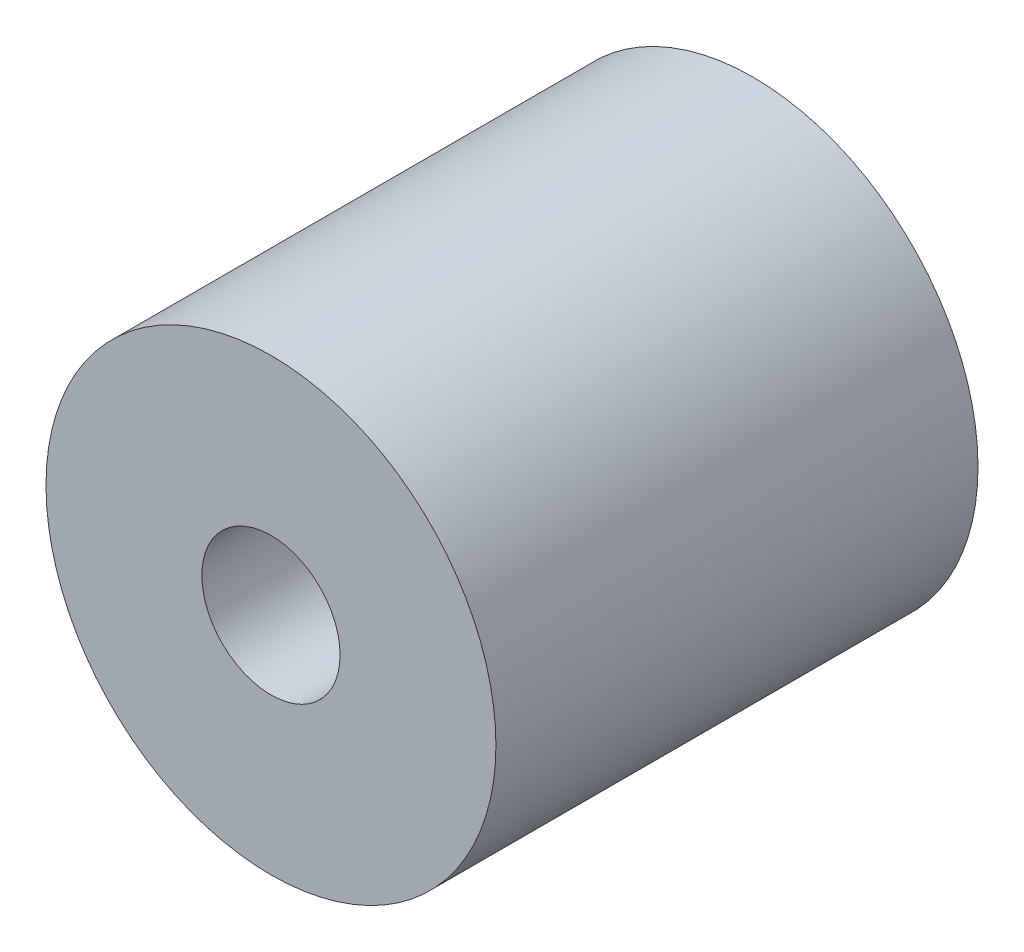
SolidWorks part; units mm, degrees
ref_plane "Plan de face" through (0, 0, 0) normal (0, 0, 1) x (1, 0, 0)
ref_plane "Plan de dessus" through (0, 0, 0) normal (0, 1, 0) x (1, 0, 0)
ref_plane "Plan de droite" through (0, 0, 0) normal (1, 0, 0) x (0, 0, -1)
sketch "Esquisse1" plane through (0, 0, 0) normal (0, 0, 1) x (1, 0, 0)
  circle A1 centre (76, 143) radius 14
  circle A2 centre (76, 143) radius 4.3 construction
  circle A3 centre (76, 143) radius 4.3
  dimension "D1" = 28
extrude "Boss.-Extru.1" add sketch "Esquisse1" along normal blind 30
